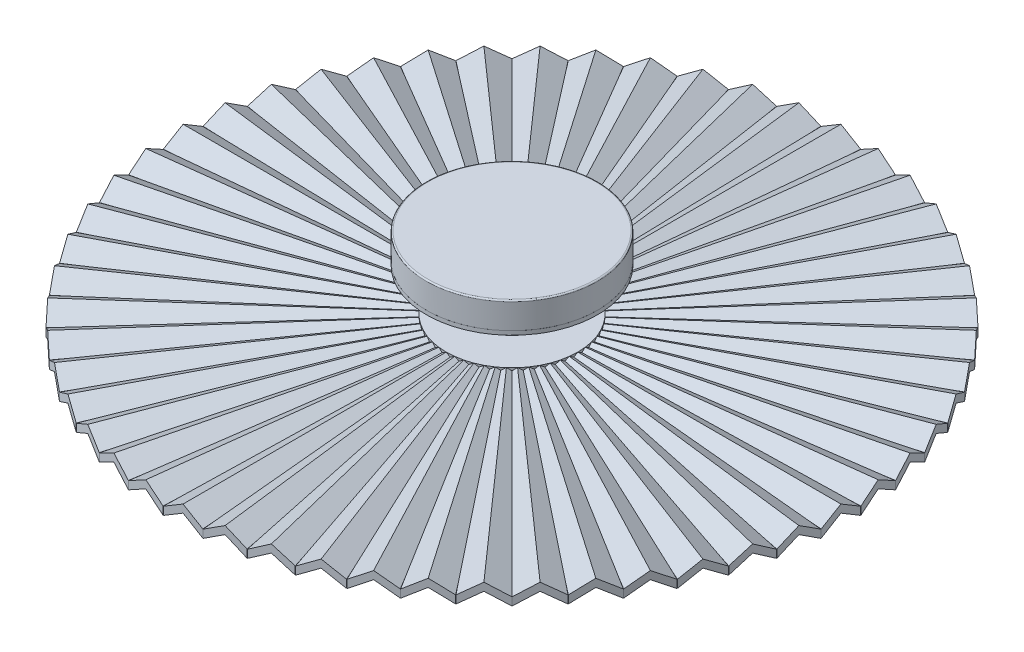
SolidWorks part; units mm, degrees
ref_plane "Alzado" through (0, 0, 0) normal (0, 0, 1) x (1, 0, 0)
ref_plane "Planta" through (0, 0, 0) normal (0, 1, 0) x (1, 0, 0)
ref_plane "Vista lateral" through (0, 0, 0) normal (1, 0, 0) x (0, 0, -1)
imported_body "A1132-50-LED.IGS<1>"
delete or keep bodies "Sólido-Eliminar/Conservar 1" type delete bodies bodies 109
ref_plane "Plano1" through (0, -5, 0) normal (0, 1, 0) x (1, 0, 0)
sketch "Croquis3" plane through (0, -5, 0) normal (0, 1, 0) x (1, 0, 0)
  circle A0 centre (0, 0) radius 99.949
  dimension "D1" = 199.898
extrude "Saliente-Extruir1" add sketch "Croquis3" against normal blind 29.972 separate body
